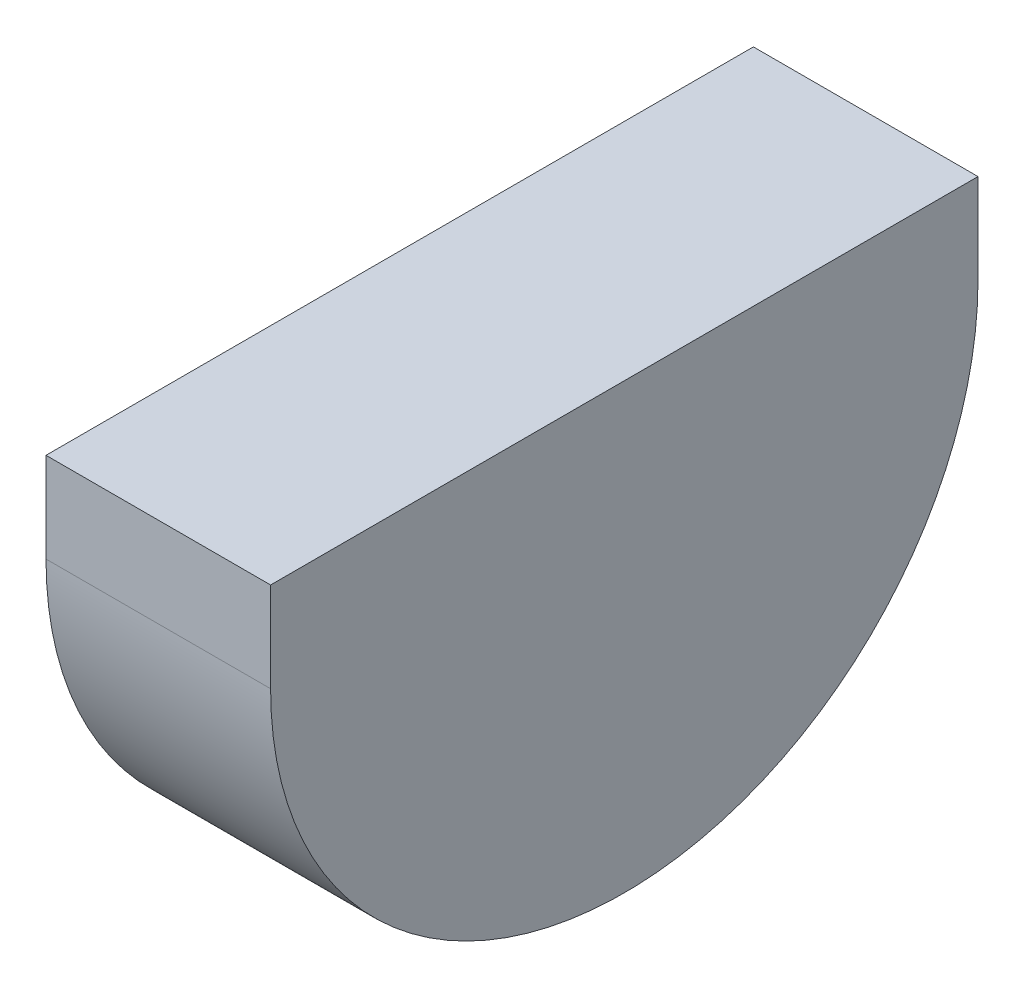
SolidWorks part; units mm, degrees
ref_plane "Front" through (0, 0, 0) normal (0, 0, 1) x (1, 0, 0)
ref_plane "Top" through (0, 0, 0) normal (0, 1, 0) x (1, 0, 0)
ref_plane "Right" through (0, 0, 0) normal (1, 0, 0) x (0, 0, -1)
sketch "Sketch1" plane through (0, 0, 0) normal (1, 0, 0) x (0, 0, -1)
  line L2 (-29.1046, 7.112) -> (-19.1046, 7.112)
  line L3 (-24.1046, -7.112) -> (-24.1046, 7.112) construction
  arc A0 (-19.1046, 7.112) -> (-29.1046, 7.112) centre (-24.1046, 7.112) cw
  dimension "D1" = 5
extrude "Extrude1" add sketch "Sketch1" along normal mid plane 3.175
sketch "Sketch2" plane through (0, 7.112, 0) normal (0, 1, 0) x (-1, 0, 0)
  line L4 (1.5875, 19.1046) -> (1.5875, 29.1046)
  line L5 (1.5875, 29.1046) -> (-1.5875, 29.1046)
  line L6 (-1.5875, 29.1046) -> (-1.5875, 19.1046)
  line L7 (-1.5875, 19.1046) -> (1.5875, 19.1046)
  line L8 (1.5875, 19.1046) -> (1.5875, 29.1046)
  line L9 (1.5875, 29.1046) -> (-1.5875, 29.1046)
  line L10 (-1.5875, 29.1046) -> (-1.5875, 19.1046)
  line L11 (-1.5875, 19.1046) -> (1.5875, 19.1046)
  dimension "D1" = 0
extrude "Extrude2" add sketch "Sketch2" along normal blind 1.27
